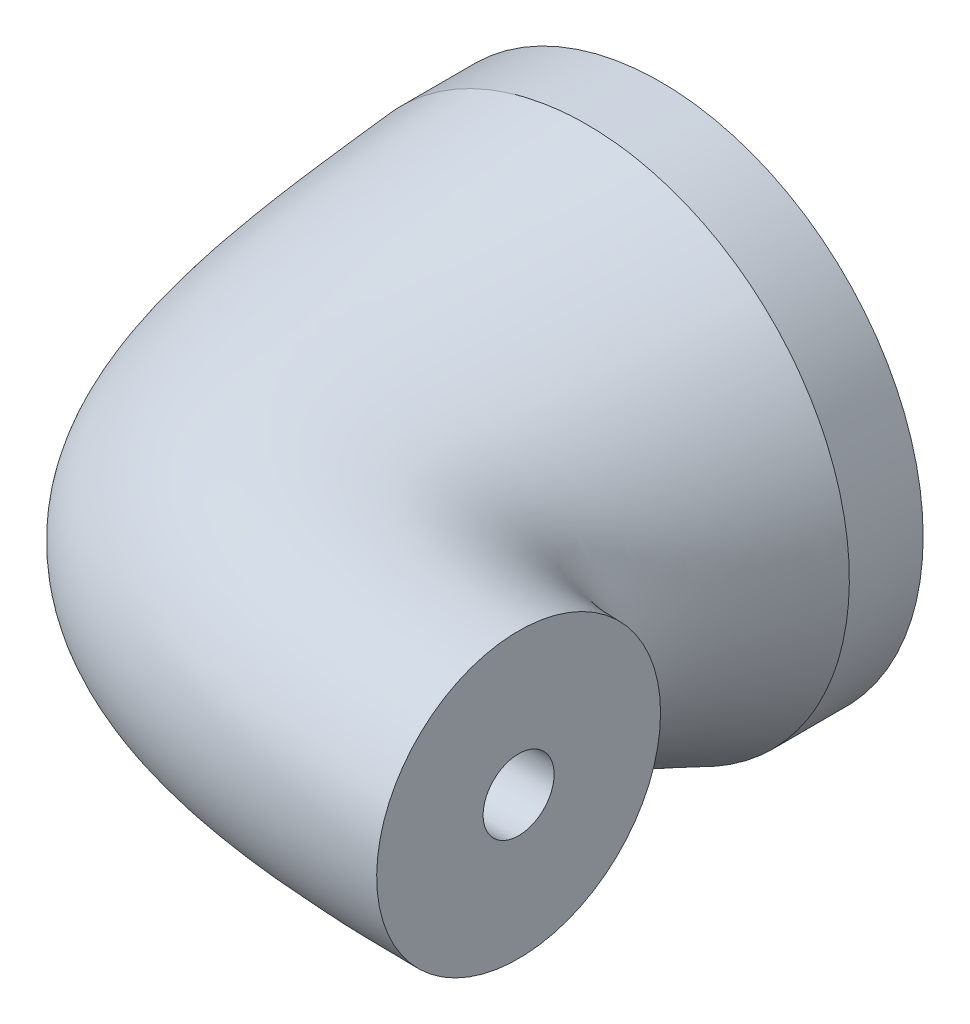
SolidWorks part; units mm, degrees
ref_plane "Ebene vorne" through (0, 0, 0) normal (0, 0, 1) x (1, 0, 0)
ref_plane "Ebene oben" through (0, 0, 0) normal (0, 1, 0) x (1, 0, 0)
ref_plane "Ebene rechts" through (0, 0, 0) normal (1, 0, 0) x (0, 0, -1)
sketch "Skizze1" plane through (0, 0, 0) normal (0, 0, 1) x (1, 0, 0)
  circle A0 centre (0, 0) radius 166
  circle A1 centre (0, 0) radius 185
  dimension "D1" = 332
  dimension "D2" = 370
extrude "Aufsatz-Linear austragen1" add sketch "Skizze1" along normal blind 50
sketch "Skizze2" plane through (0, 0, 50) normal (0, 0, 1) x (1, 0, 0)
  circle A1 centre (0, 0) radius 185
  circle A2 centre (0, 0) radius 185
  dimension "D1" = 0
extrude "Aufsatz-Linear austragen2" add sketch "Skizze2" along normal blind 2
ref_plane "Ebene1" through (200, 0, 0) normal (1, 0, 0) x (0, 0, -1)
sketch "Skizze4" plane through (200, 0, 0) normal (1, 0, 0) x (0, 0, -1)
  circle A0 centre (-300, 0) radius 100
  point P2 (0, 0)
  dimension "D1" = 200
  dimension "D2" = 300
other "Begrenzung1"
sketch "Skizze5" plane through (200, 0, 0) normal (1, 0, 0) x (0, 0, -1)
  circle A0 centre (-300, 0) radius 25
  dimension "D1" = 50
extrude "Schnitt-Linear austragen1" cut sketch "Skizze5" against normal blind 50
